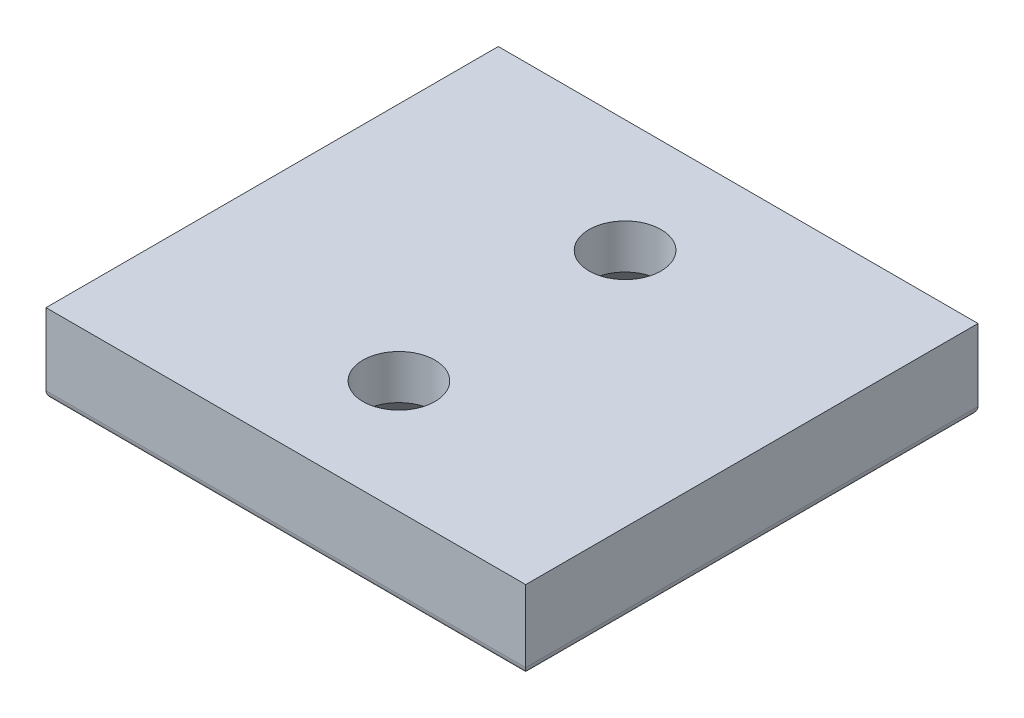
SolidWorks part; units mm, degrees
ref_plane "Front Plane" through (0, 0, 0) normal (0, 0, 1) x (1, 0, 0)
ref_plane "Top Plane" through (0, 0, 0) normal (0, 1, 0) x (1, 0, 0)
ref_plane "Right Plane" through (0, 0, 0) normal (1, 0, 0) x (0, 0, -1)
sketch "Sketch1" plane through (0, 0, 0) normal (0, 1, 0) x (1, 0, 0)
  line L1 (-30, -28.285) -> (30, -28.285)
  line L2 (-30, -28.285) -> (-30, 28.285)
  line L3 (-30, 28.285) -> (30, 28.285)
  line L4 (30, -28.285) -> (30, 28.285)
  line L5 (-30, -28.285) -> (30, 28.285) construction
  line L6 (-30, 28.285) -> (30, -28.285) construction
  point P0 (0, 0)
  dimension "D1" = 60
  dimension "D2" = 56.57
extrude "Boss-Extrude1" add sketch "Sketch1" along normal blind 10
fillet "Fillet1" radius 1 4 edges at (0, 0, -28.285) (-30, 0, 0) (0, 0, 28.285) (30, 0, 0)
hole_wizard "CSK for M8 Hex Socket Countersunk Cap Screw1" positions "Sketch2" profile "Sketch4" countersink size "M8" standard "ISO"
sketch "Sketch2" plane through (0, 0, 0) normal (0, -1, 0) x (-1, 0, 0)
  point P0 (0, -14.1425)
  point P2 (0, 14.1425)
  point P17 (0, 0)
  point P19 (0, 0)
sketch "Sketch4" plane through (0, 0, 14.1425) normal (1, 0, 0) x (0, 0, -1)
  line L0 (0, 0) -> (0, 10)
  line L1 (0, 10) -> (4.5, 10)
  line L2 (4.5, 10) -> (4.5, 4.46)
  line L3 (4.5, 4.46) -> (8.96, 0)
  line L5 (8.96, 0) -> (0, 0)
  line L6 (-4.5, 4.46) -> (-8.96, 0) construction
  line L11 (0, -6.35) -> (0, 107.95) construction
  dimension "Thru Hole Dia." = 9
  dimension "Thru Hole Depth" = 10
  dimension "Near C'Sink Dia." = 17.92
  dimension "Near C'Sink Angle" = 90
